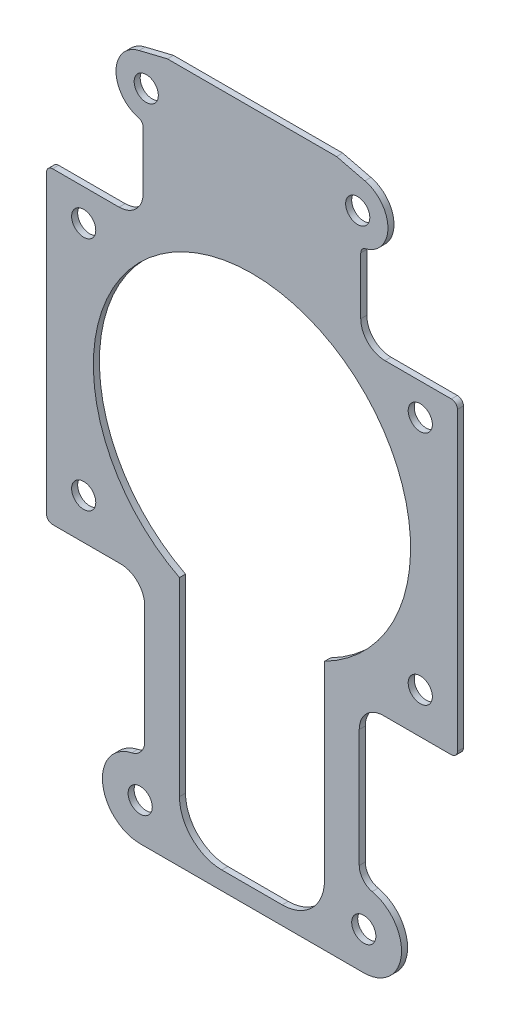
SolidWorks part; units mm, degrees
ref_plane "Plan1" through (0, 0, 0) normal (0, 0, 1) x (1, 0, 0)
ref_plane "Plan2" through (0, 0, 0) normal (0, 1, 0) x (1, 0, 0)
ref_plane "Plan3" through (0, 0, 0) normal (1, 0, 0) x (0, 0, -1)
sketch "Esquisse1" plane through (0, 0, 0) normal (0, 0, 1) x (1, 0, 0)
  line L0 (-12, 40.6534) -> (-12, 9.25) construction
  line L1 (-5, 2.25) -> (5, 2.25) construction
  line L2 (12, 9.25) -> (12, 40.6534) construction
  line L3 (-12, 40.6534) -> (-12, 9.25)
  line L4 (-5, 2.25) -> (5, 2.25)
  line L5 (12, 9.25) -> (12, 40.6534)
  line L14 (-18, 102.1905) -> (-18, 92.75)
  line L15 (-22, 88.75) -> (-33, 88.75)
  line L16 (-34, 87.75) -> (-34, 38.75)
  line L17 (-33, 37.75) -> (-21.75, 37.75)
  line L18 (-17.75, 33.75) -> (-17.75, 14.275)
  line L19 (-18.5, -0.75) -> (18.5, -0.75)
  line L20 (17.75, 14.275) -> (17.75, 33.75)
  line L21 (21.75, 37.75) -> (33, 37.75)
  line L22 (34, 38.75) -> (34, 87.75)
  line L23 (33, 88.75) -> (22, 88.75)
  line L24 (18, 92.75) -> (18, 102.1905)
  line L25 (18.6846, 112.8577) -> (14, 114)
  line L26 (14, 114) -> (-14, 114)
  line L27 (-14, 114) -> (-18.6846, 112.8577)
  line L28 (-18, 102.1905) -> (-18, 92.75)
  line L29 (-22, 88.75) -> (-33, 88.75)
  line L30 (-34, 87.75) -> (-34, 38.75)
  line L31 (-33, 37.75) -> (-21.75, 37.75)
  line L32 (-17.75, 33.75) -> (-17.75, 14.275)
  line L33 (-18.5, -0.75) -> (18.5, -0.75)
  line L34 (17.75, 14.275) -> (17.75, 33.75)
  line L35 (21.75, 37.75) -> (33, 37.75)
  line L36 (34, 38.75) -> (34, 87.75)
  line L37 (33, 88.75) -> (22, 88.75)
  line L38 (18, 92.75) -> (18, 102.1905)
  line L39 (18.6846, 112.8577) -> (14, 114)
  line L40 (14, 114) -> (-14, 114)
  line L41 (-14, 114) -> (-18.6846, 112.8577)
  arc A0 (-12, 9.25) -> (-5, 2.25) centre (-5, 9.25) ccw construction
  arc A1 (5, 2.25) -> (12, 9.25) centre (5, 9.25) ccw construction
  arc A2 (12, 40.6534) -> (-12, 40.6534) centre (0, 64) ccw construction
  arc A3 (-12, 9.25) -> (-5, 2.25) centre (-5, 9.25) ccw
  arc A4 (5, 2.25) -> (12, 9.25) centre (5, 9.25) ccw
  arc A5 (12, 40.6534) -> (-12, 40.6534) centre (0, 64) ccw
  circle A6 centre (-18.5, 5.5) radius 2 construction
  circle A7 centre (18.5, 5.5) radius 2 construction
  circle A8 centre (-18.5, 5.5) radius 2
  circle A9 centre (18.5, 5.5) radius 2
  circle A10 centre (-27.8512, 44.4984) radius 2 construction
  circle A11 centre (27.8512, 44.4984) radius 2 construction
  circle A12 centre (-27.8512, 44.4984) radius 2
  circle A13 centre (27.8512, 44.4984) radius 2
  circle A14 centre (-27.8512, 83.5016) radius 2 construction
  circle A15 centre (27.8512, 83.5016) radius 2 construction
  arc A16 (-18.6846, 112.8577) -> (-18.75, 103.1588) centre (-17.5, 108) ccw
  arc A17 (-18, 102.1905) -> (-18.75, 103.1588) centre (-19, 102.1905) ccw
  arc A18 (-22, 88.75) -> (-18, 92.75) centre (-22, 92.75) ccw
  arc A19 (-33, 88.75) -> (-34, 87.75) centre (-33, 87.75) ccw
  arc A20 (-34, 38.75) -> (-33, 37.75) centre (-33, 38.75) ccw
  arc A21 (-17.75, 33.75) -> (-21.75, 37.75) centre (-21.75, 33.75) ccw
  arc A22 (-19.8889, 11.5937) -> (-17.75, 14.275) centre (-20.5, 14.275) ccw
  arc A23 (-19.8889, 11.5937) -> (-18.5, -0.75) centre (-18.5, 5.5) ccw
  arc A24 (18.5, -0.75) -> (19.8889, 11.5937) centre (18.5, 5.5) ccw
  arc A25 (17.75, 14.275) -> (19.8889, 11.5937) centre (20.5, 14.275) ccw
  arc A26 (21.75, 37.75) -> (17.75, 33.75) centre (21.75, 33.75) ccw
  arc A27 (33, 37.75) -> (34, 38.75) centre (33, 38.75) ccw
  arc A28 (34, 87.75) -> (33, 88.75) centre (33, 87.75) ccw
  arc A29 (18, 92.75) -> (22, 88.75) centre (22, 92.75) ccw
  arc A30 (18.75, 103.1588) -> (18, 102.1905) centre (19, 102.1905) ccw
  arc A31 (18.75, 103.1588) -> (18.6846, 112.8577) centre (17.5, 108) ccw
  arc A32 (-18.6846, 112.8577) -> (-18.75, 103.1588) centre (-17.5, 108) ccw
  arc A33 (-18, 102.1905) -> (-18.75, 103.1588) centre (-19, 102.1905) ccw
  arc A34 (-22, 88.75) -> (-18, 92.75) centre (-22, 92.75) ccw
  arc A35 (-33, 88.75) -> (-34, 87.75) centre (-33, 87.75) ccw
  arc A36 (-34, 38.75) -> (-33, 37.75) centre (-33, 38.75) ccw
  arc A37 (-17.75, 33.75) -> (-21.75, 37.75) centre (-21.75, 33.75) ccw
  arc A38 (-19.8889, 11.5937) -> (-17.75, 14.275) centre (-20.5, 14.275) ccw
  arc A39 (-19.8889, 11.5937) -> (-18.5, -0.75) centre (-18.5, 5.5) ccw
  arc A40 (18.5, -0.75) -> (19.8889, 11.5937) centre (18.5, 5.5) ccw
  arc A41 (17.75, 14.275) -> (19.8889, 11.5937) centre (20.5, 14.275) ccw
  arc A42 (21.75, 37.75) -> (17.75, 33.75) centre (21.75, 33.75) ccw
  arc A43 (33, 37.75) -> (34, 38.75) centre (33, 38.75) ccw
  arc A44 (34, 87.75) -> (33, 88.75) centre (33, 87.75) ccw
  arc A45 (18, 92.75) -> (22, 88.75) centre (22, 92.75) ccw
  arc A46 (18.75, 103.1588) -> (18, 102.1905) centre (19, 102.1905) ccw
  arc A47 (18.75, 103.1588) -> (18.6846, 112.8577) centre (17.5, 108) ccw
  circle A48 centre (-27.8512, 83.5016) radius 2
  circle A49 centre (27.8512, 83.5016) radius 2
  circle A50 centre (-17.5, 108) radius 2 construction
  circle A51 centre (17.5, 108) radius 2 construction
  circle A52 centre (-17.5, 108) radius 2
  circle A53 centre (17.5, 108) radius 2
  dimension "D1" = 0
extrude "Base-Extrusion" add sketch "Esquisse1" along normal blind 1
